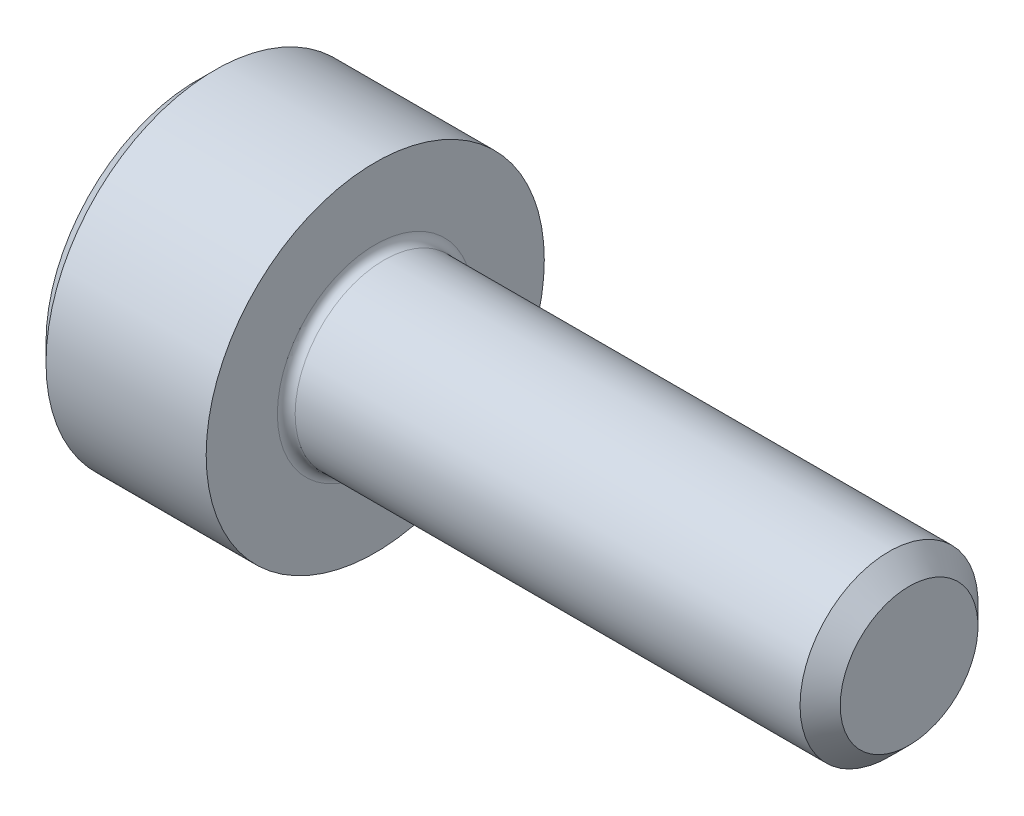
SolidWorks part; units mm, degrees
revolve "Base-Revolve" add sketch "BodySke"
sketch "BodySke" plane through (0, 0, 0) normal (0, 0, 1) x (1, 0, 0)
  line L0 (0, 0) -> (0, 1.7)
  line L1 (0.2, 1.9) -> (2, 1.9)
  line L2 (2, 1.9) -> (2, 1)
  line L3 (2, 1) -> (7.774, 1)
  line L4 (8, 0.774) -> (8, 0)
  line L5 (8, 0) -> (0, 0)
  line L6 (-31.75, 0) -> (127, 0) construction
  line L7 (0, 1.7) -> (0.2, 1.9)
  line L8 (8, 0.774) -> (7.774, 1)
  line L9 (0, -1.7) -> (0.2, -1.9) construction
  line L10 (8, -0.774) -> (7.774, -1) construction
  line L11 (2.4, 9.525) -> (2.4, 3.175) construction
  line L12 (2, 9.525) -> (2, 3.175) construction
  line L13 (-42, 9.525) -> (-42, 3.175) construction
  dimension "Diameter" = 2
  dimension "Head_ht" = 2
  dimension "Length" = 6
  dimension "Body_ch_ang" = 45
  dimension "Head_dia" = 3.8
  dimension "Head_ch_ang" = 45
  dimension "Minor_dia" = 1.548
  dimension "Advance" = 0.4
  dimension "Thread_nom" = 6
  dimension "Thread_length" = 50
  dimension "Head_ch_ht" = 0.2
fillet "Fillet1" radius 0.1 1 edges at (2, 0, 1)
ref_plane "Plane1" through (0, 0, 0) normal (0, 0, 1) x (1, 0, 0)
ref_plane "Plane2" through (0, 0, 0) normal (0, 1, 0) x (1, 0, 0)
ref_plane "Plane3" through (0, 0, 0) normal (1, 0, 0) x (0, 0, -1)
sketch "Sketch2" plane through (0, 0, 0) normal (0, 0, 1) x (1, 0, 0)
  line L0 (0, 0.7725) -> (1, 0.7725)
  line L1 (1, 0.7725) -> (1.446, 0)
  line L2 (-31.75, 0) -> (127, 0) construction
  line L3 (1.446, 0) -> (0, 0)
  line L4 (0, 0) -> (0, 0.7725)
  line L5 (0, 1.7) -> (0, -1.7) construction
  line L6 (0, 0) -> (47.625, 0) construction
  line L7 (2, -1.9) -> (2, 1.9) construction
revolve "Hex-PreBroach" cut sketch "Sketch2" angle 360 about L6
sketch "Sketch3" plane through (0, 0, 0) normal (-1, 0, 0) x (0, 0.5, 0.866)
  line L0 (0.446, 0.7725) -> (-0.446, 0.7725)
  line L1 (-0.446, 0.7725) -> (-0.892, 0)
  line L2 (0.446, 0.7725) -> (0.892, 0)
  line L3 (0.446, -0.7725) -> (0.892, 0)
  line L4 (0.446, -0.7725) -> (-0.446, -0.7725)
  line L5 (-0.446, -0.7725) -> (-0.892, 0)
extrude "Hex" cut sketch "Sketch3" against normal blind 1
sketch "Sketch4" plane through (0, 0, 0) normal (-1, 0, 0) x (0, 0, 1)
  line L0 (0, 0) -> (0.9398, 0)
  line L1 (0, 0) -> (6.1484, 3.5498) construction
  line L2 (0, 0) -> (0.4699, 0.8139)
  line L3 (0.7832, 0.2175) -> (0.8962, 0.2828)
  line L4 (0.58, 0.5695) -> (0.693, 0.6348)
  arc A0 (0.7832, 0.2175) -> (0.58, 0.5695) centre (0, 0) ccw
  arc A1 (0.9398, 0) -> (0.8962, 0.2828) centre (0, 0) ccw
  arc A2 (0.4699, 0.8139) -> (0.693, 0.6348) centre (0, 0) cw
extrude "Spline" [suppressed] cut sketch "Sketch4" against normal blind 1
pattern_circular "CirPattern1" [suppressed] count 6 every 60
sketch "Sketch5" plane through (0, 0, 0) normal (0, 0, 1) x (1, 0, 0)
  line L0 (-31.75, 0) -> (127, 0) construction
  line L2 (0, 1.7) -> (0, -1.7) construction
  circle A0 centre (0.1, 0) radius 0.005
  dimension "Drilled_hole_dia" = 0.01
  dimension "Drilled_hole_loc" = 0.1
extrude "Hole" [suppressed] cut sketch "Sketch5" against normal through all and the other way through all
pattern_circular "Drilled-4" [suppressed] count 2 every 60
pattern_circular "Drilled-6" [suppressed] count 3 every 60
sketch "ThdSchSke" plane through (0, 0, 0) normal (0, 0, 1) x (1, 0, 0)
  line L0 (2.4, -0.774) -> (2.2418, -1)
  line L1 (2.4, -0.774) -> (2.5582, -1)
  line L2 (2.5582, -1) -> (2.5582, -1.25)
  line L3 (-3.175, 0) -> (5.1513, 0) construction
  line L5 (2.5582, -1.25) -> (2.2418, -1.25)
  line L6 (2.2418, -1.25) -> (2.2418, -1)
  line L7 (0, 1.7) -> (0, -1.7) construction
revolve "ThreadSchematic" [suppressed] cut sketch "ThdSchSke" angle 360 about L3
pattern_linear "ThdSchPat" [suppressed]
equation "\"D2@Sketch3\" = \"Hex_size@Sketch3\" / 2"
equation "\"D1@Sketch3\" = \"Hex_size@Sketch3\" / 2"
equation "\"D1@Sketch2\" = \"Hex_size@Sketch3\" / 2"
equation "\"D3@Sketch4\" = \"Spline_p_dim@Sketch4\" / 2"
equation "\"Thread_minor@ThreadCosmetic\"  =  \"Minor_dia@BodySke\""
equation "\"D2@CirPattern1\" = 360 / \"Num_teeth@CirPattern1\""
equation "\"Wall_thickness@Sketch2\" = \"Head_ht@BodySke\" - \"Key_eng@Hex\""
equation "\"Thread_length@ThreadCosmetic\" = ((sgn( (\"Length@BodySke\" - \"Advance@BodySke\" ) - \"Thread_nom@BodySke\" )-1)*( (\"Length@BodySke\" - \"Advance@BodySke\" ) - \"Thread_nom@BodySke\" ))/-2+ \"Thread_nom@BodySke\""
equation "\"Thread_minor@ThdSchSke\" = \"Minor_dia@BodySke\""
equation "\"Diameter@ThdSchSke\" = \"Diameter@BodySke\""
equation "\"Overcut@ThdSchSke\" = \"Diameter@BodySke\" * 1.25"
equation "\"Start@ThdSchSke\" = \"Head_ht@BodySke\" + \"Length@BodySke\" - \"Thread_length@ThreadCosmetic\"  '---Non-countersunk---"
equation "\"Num_threads@ThdSchPat\" = int( \"Thread_length@ThreadCosmetic\" / \"Advance@BodySke\" + 0.999 )  + 1"
equation "\"Advance@ThdSchPat\" = \"Thread_length@ThreadCosmetic\" /  (\"Num_threads@ThdSchPat\" - 1) 'relax it"
equation "\"Num_threads@ThdSchPat\" = \"Num_threads@ThdSchPat\" - sgn( \"Num_threads@ThdSchPat\" - 1) '---chamfered tips only---"
